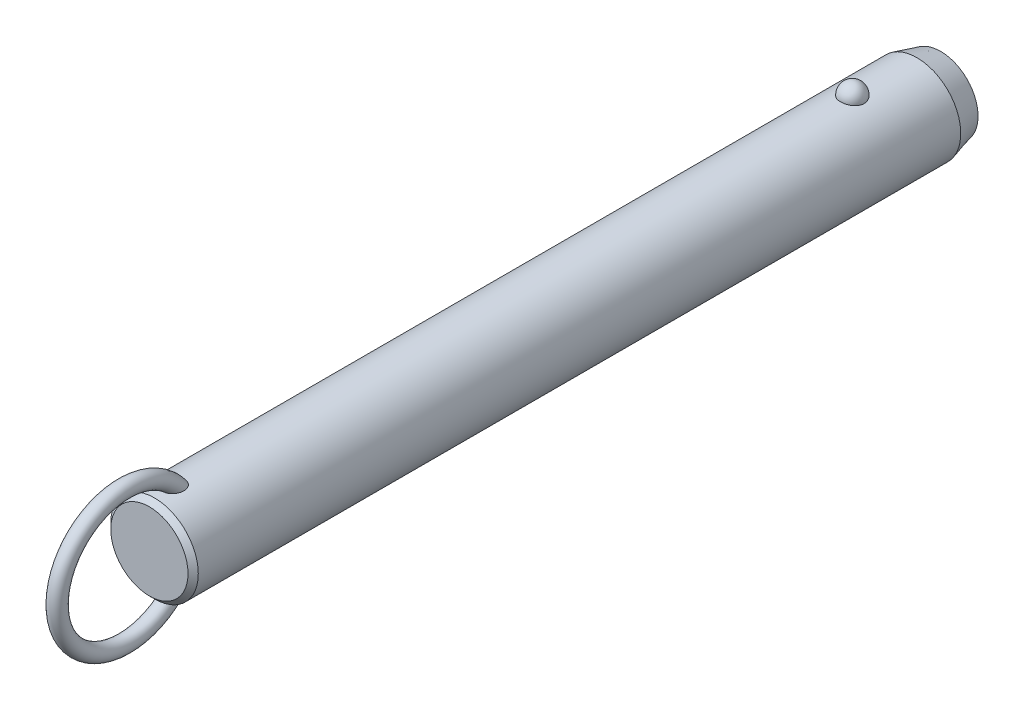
SolidWorks part; units mm, degrees
ref_plane "Front Plane" through (0, 0, 0) normal (0, 0, 1) x (1, 0, 0)
ref_plane "Top Plane" through (0, 0, 0) normal (0, 1, 0) x (1, 0, 0)
ref_plane "Right Plane" through (0, 0, 0) normal (1, 0, 0) x (0, 0, -1)
sketch "Sketch2" plane through (0, 0, 0) normal (0, 0, 1) x (1, 0, 0)
  circle A0 centre (0, 0) radius 11.1
  point P3 (0, 11.1)
  dimension "D1" = 22.2
extrude "Boss-Extrude1" add sketch "Sketch2" along normal blind 162.6
sketch "Sketch3" plane through (0, 0, 0) normal (0, 0, -1) x (-1, 0, 0)
  circle A0 centre (0, 0) radius 11.1
  dimension "D1" = 22.2
extrude "Boss-Extrude2" add sketch "Sketch3" along normal blind 25.4
chamfer "Chamfer1" distance 6 angle 15 1 edges at (-11.1, 0, -25.4)
sketch "Sketch12" plane through (0, 0, 0) normal (1, 0, 0) x (0, 0, -1)
  line L0 (-162.6, 11.1) -> (-162.6, -11.1) construction
  point P0 (-162.6, 0)
sketch "Sketch13" plane through (0, 0, 0) normal (1, 0, 0) x (0, 0, -1)
  circle A0 centre (-181.65, 0) radius 19.05
  point P2 (-162.6, 0)
  dimension "D1" = 38.1
sketch "Sketch14" plane through (0, 0, 0) normal (0, 1, 0) x (1, 0, 0)
  circle A0 centre (0, -164.6) radius 2
  point P2 (0, -162.6)
  dimension "D1" = 4
sweep "Sweep1" add profiles "Sketch14" path "Sketch13"
sketch "Sketch15" plane through (0, 0, 162.6) normal (0, 0, 1) x (1, 0, 0)
  circle A0 centre (0, 0) radius 11.1
  dimension "D1" = 22.2
extrude "Boss-Extrude3" add sketch "Sketch15" along normal blind 12.7
chamfer "Chamfer2" distance 1.3 angle 45 1 edges at (11.1, 0, 175.3)
sketch "Sketch18" plane through (0, 0, 0) normal (1, 0, 0) x (0, 0, -1)
  line L0 (19.4, 11.1) -> (-166.168, 11.1) construction
  line L1 (3, 14.1) -> (3, 8.1)
  line L2 (-166.168, -11.1) -> (19.4, -11.1) construction
  arc A0 (3, 14.1) -> (3, 8.1) centre (3, 11.1) ccw
  point P4 (0, 11.1)
  dimension "D1" = 25.2
revolve "Revolve1" add sketch "Sketch18" angle 360 about L1
